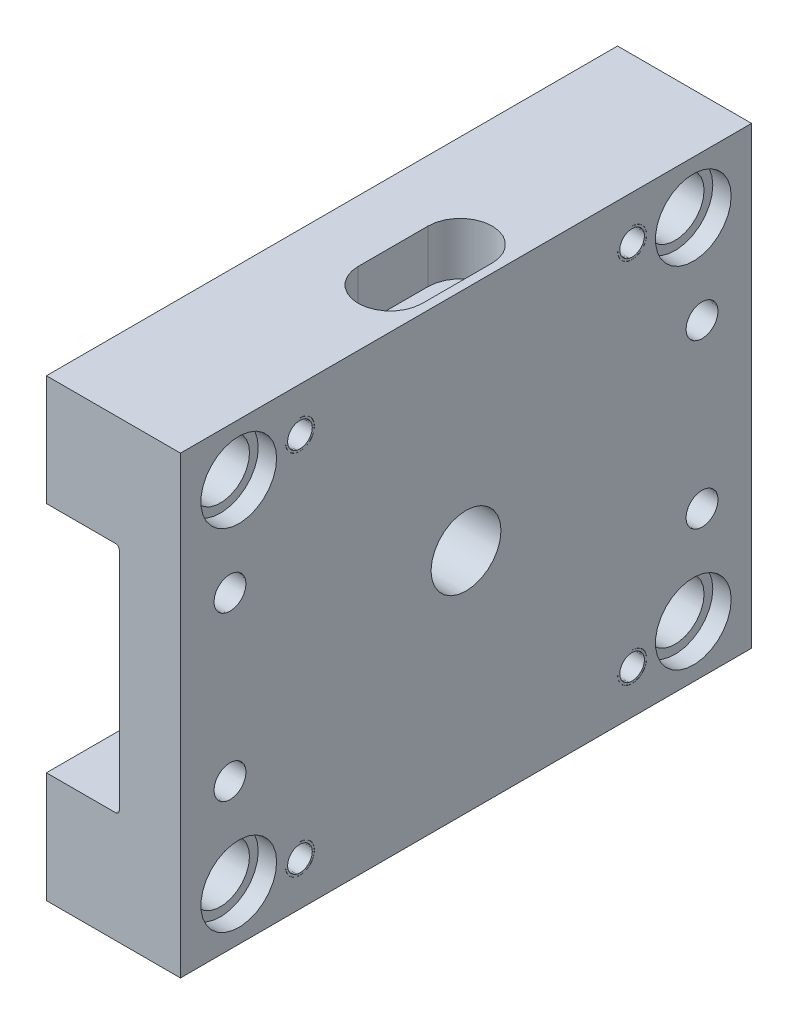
SolidWorks part; units mm, degrees
ref_plane "Plan de face" through (0, 0, 0) normal (0, 0, 1) x (1, 0, 0)
ref_plane "Plan de dessus" through (0, 0, 0) normal (0, 1, 0) x (1, 0, 0)
ref_plane "Plan de droite" through (0, 0, 0) normal (1, 0, 0) x (0, 0, -1)
imported_body "Importée1"
sketch "Esquisse1" plane through (46, 0, 0) normal (1, 0, 0) x (0, 0, -1)
  circle A0 centre (0, 0) radius 12
  dimension "D1" = 24
extrude "Enlèv. mat.-Extru.1" cut sketch "Esquisse1" against normal through all
